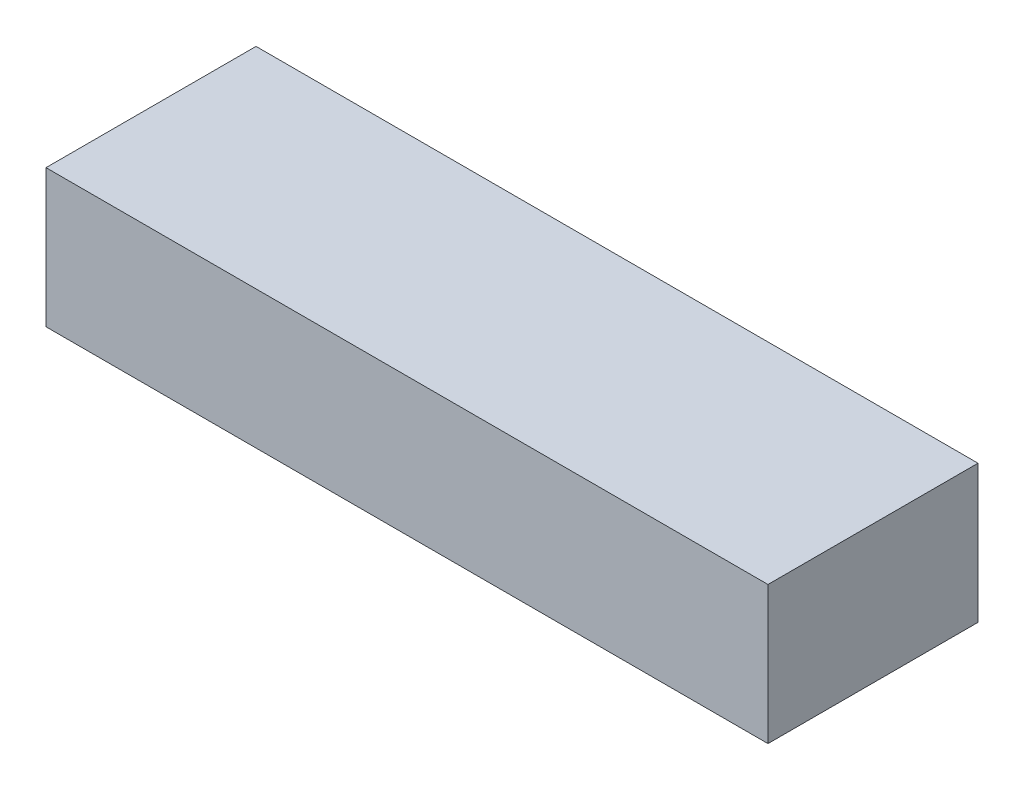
SolidWorks part; units mm, degrees
ref_plane "前视基准面" through (0, 0, 0) normal (0, 0, 1) x (1, 0, 0)
ref_plane "上视基准面" through (0, 0, 0) normal (0, 1, 0) x (1, 0, 0)
ref_plane "右视基准面" through (0, 0, 0) normal (1, 0, 0) x (0, 0, -1)
sketch "草图1" plane through (0, 0, 0) normal (0, 1, 0) x (1, 0, 0)
  line L1 (-55, 16) -> (55, 16)
  line L2 (-55, 16) -> (-55, -16)
  line L3 (-55, -16) -> (55, -16)
  line L4 (55, 16) -> (55, -16)
  line L5 (-55, 16) -> (55, -16) construction
  line L6 (-55, -16) -> (55, 16) construction
  point P0 (0, 0)
extrude "凸台-拉伸1" add sketch "草图1" along normal blind 21
